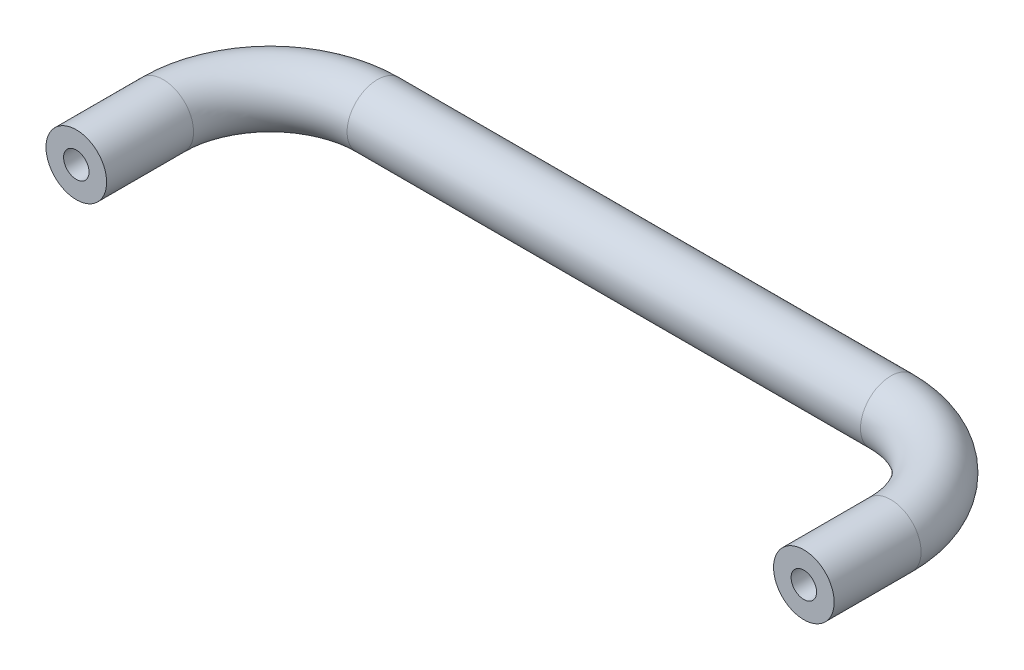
SolidWorks part; units mm, degrees
ref_plane "Front Plane" through (0, 0, 0) normal (0, 0, 1) x (1, 0, 0)
ref_plane "Top Plane" through (0, 0, 0) normal (0, 1, 0) x (1, 0, 0)
ref_plane "Right Plane" through (0, 0, 0) normal (1, 0, 0) x (0, 0, -1)
sketch "Sketch1" plane through (0, 0, 0) normal (0, 1, 0) x (1, 0, 0)
  line L0 (-42.3403, 0) -> (42.3403, 0)
  line L1 (60, -17.6597) -> (60, -32)
  line L2 (-60, -17.6597) -> (-60, -32)
  line L3 (0, 43.5456) -> (0, -43.5456) construction
  arc A0 (42.3403, 0) -> (60, -17.6597) centre (42.3403, -17.6597) cw
  arc A1 (-42.3403, 0) -> (-60, -17.6597) centre (-42.3403, -17.6597) ccw
  point P12 (0, 0)
  dimension "D1" = 32
  dimension "D2" = 120
  dimension "D3" = 60
ref_plane "Plane1" through (-60, 0, 32) normal (0, 0, -1) x (-1, 0, 0)
sketch "Sketch2" plane through (-60, 0, 32) normal (0, 0, -1) x (-1, 0, 0)
  line L0 (0, 0) -> (-17.6597, 0) construction
  circle A0 centre (0, 0) radius 5
  dimension "D1" = 10
sweep "Sweep1" add profiles "Sketch2" path "Sketch1"
sketch "Sketch3" plane through (0, 0, 32) normal (0, 0, 1) x (1, 0, 0)
  point P0 (-60, 0)
  point P1 (60, 0)
hole_wizard "Tap Drill for M5 Tap1" positions "Sketch3" profile "Sketch8" hole size "M5" standard "DIN"
sketch "Sketch8" plane through (-60, 0, 32) normal (1, 0, 0) x (0, -1, 0)
  line L0 (0, 0) -> (0, 16.2618)
  line L1 (0, 16.2618) -> (2.1, 15)
  line L2 (2.1, 15) -> (2.1, 0)
  line L5 (2.1, 0) -> (0, 0)
  line L10 (0, 16.2618) -> (-2.1, 15) construction
  line L11 (0, -6.35) -> (0, 107.95) construction
  dimension "Hole Dia." = 4.2
  dimension "Hole Depth" = 15
  dimension "Drill Angle" = 118
